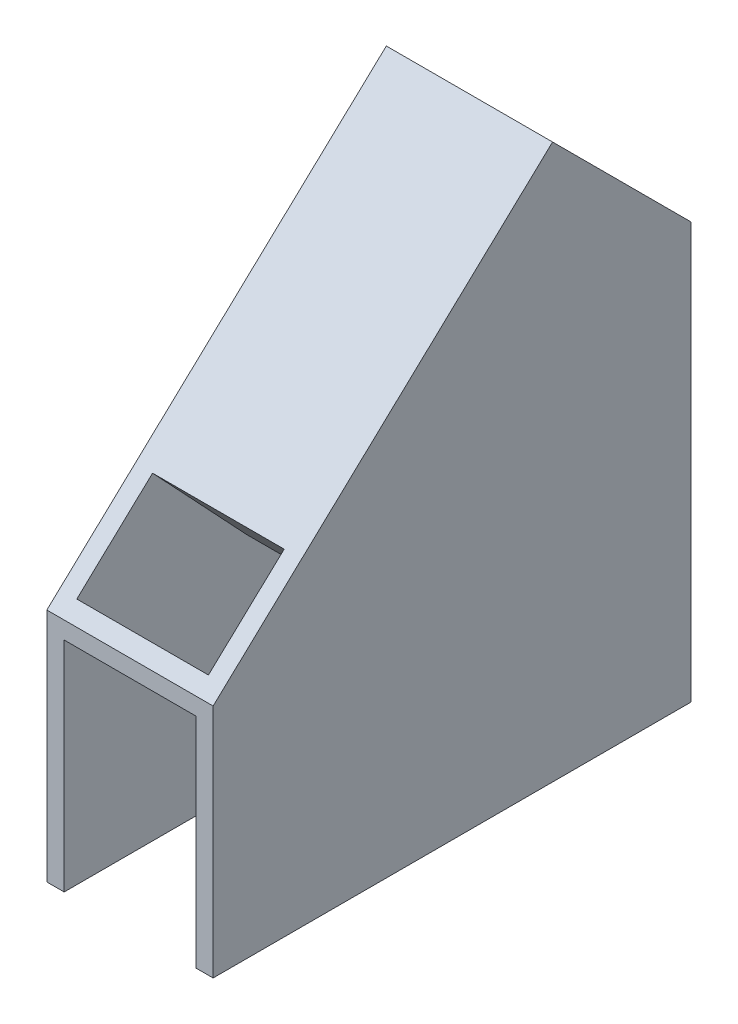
SolidWorks part; units mm, degrees
ref_plane "Alzado" through (0, 0, 0) normal (0, 0, 1) x (1, 0, 0)
ref_plane "Planta" through (0, 0, 0) normal (0, 1, 0) x (1, 0, 0)
ref_plane "Vista lateral" through (0, 0, 0) normal (1, 0, 0) x (0, 0, -1)
sketch "Sketch1" plane through (0, 0, 0) normal (0, 1, 0) x (1, 0, 0)
  line L5 (-2.4, -6.9) -> (2.4, -6.9)
  line L6 (-2.4, -6.9) -> (-2.4, 6.9)
  line L7 (-2.4, 6.9) -> (2.4, 6.9)
  line L8 (2.4, -6.9) -> (2.4, 6.9)
  line L9 (0, 6.9) -> (0, -6.9) construction
  line L10 (-2.4, 0) -> (2.4, 0) construction
  point P0 (0, 0)
  dimension "D1" = 4.8
  dimension "D2" = 13.8
extrude "Boss-Extrude1" add sketch "Sketch1" along normal blind 16
chamfer "Chamfer1" distance 4 1 edges at (0, 16, -6.9)
chamfer "Chamfer2" distance 9.2 distance2 9.8 1 edges at (0, 16, 6.9)
sketch "Sketch2" plane through (0, 9.45, -9.45) normal (0, 0.7071, -0.7071) x (-1, 0, 0)
  line L0 (2.4, 9.2631) -> (-2.4, 3.6062) construction
  circle A0 centre (0, 6.4347) radius 1.6
  dimension "D1" = 3.2
extrude "Cut-Extrude1" cut sketch "Sketch2" against normal blind 2
sketch "Sketch3" plane through (0, 0, 6.9) normal (0, 0, 1) x (1, 0, 0)
  line L3 (-1.9, 0) -> (1.9, 0)
  line L6 (-1.9, 0) -> (-1.9, 6.3)
  line L7 (-1.9, 6.3) -> (1.9, 6.3)
  line L8 (1.9, 6.3) -> (1.9, 0)
  line L9 (-1.9, 0) -> (-1.9, 6.3)
  line L10 (-1.9, 6.3) -> (1.9, 6.3)
  line L11 (1.9, 6.3) -> (1.9, 0)
  dimension "D1" = 0.5
extrude "Cut-Extrude2" cut sketch "Sketch3" against normal blind 6.5
sketch "Sketch4" plane through (0, 7.0576, 6.6255) normal (0, 0.7291, 0.6844) x (1, 0, 0)
  line L3 (-1.9, 3.1236) -> (1.9, 3.1236)
  line L6 (1.9, 13.0653) -> (1.9, 0.1236)
  line L7 (1.9, 0.1236) -> (-1.9, 0.1236)
  line L8 (-1.9, 0.1236) -> (-1.9, 13.0653)
  line L9 (1.9, 3.1236) -> (1.9, 0.1236)
  line L10 (1.9, 0.1236) -> (-1.9, 0.1236)
  line L11 (-1.9, 0.1236) -> (-1.9, 3.1236)
  dimension "D2" = 3
  dimension "D1" = 0.5
extrude "Cut-Extrude3" cut sketch "Sketch4" against normal blind 5
